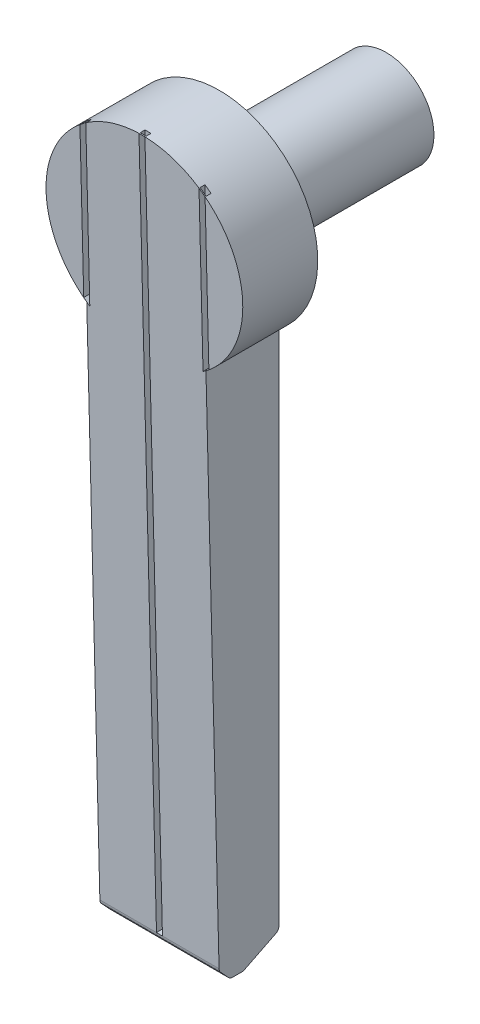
SolidWorks part; units mm, degrees
ref_plane "前视基准面" through (0, 0, 0) normal (0, 0, 1) x (1, 0, 0)
ref_plane "上视基准面" through (0, 0, 0) normal (0, 1, 0) x (1, 0, 0)
ref_plane "右视基准面" through (0, 0, 0) normal (1, 0, 0) x (0, 0, -1)
sketch "草图1" plane through (0, 0, 0) normal (0, 0, 1) x (1, 0, 0)
  line L0 (0, 0) -> (0, 81.7425) construction
  line L1 (-10, -60) -> (10, -60)
  line L2 (-10, -60) -> (-10, 30.3756)
  line L4 (10, -60) -> (10, 30.3756)
  line L5 (-10, -60) -> (9.4986, 56.9917) construction
  line L6 (-9.4986, 56.9917) -> (10, -60) construction
  arc A0 (10, 30.3756) -> (-10, 30.3756) centre (0, 43.5) ccw
  point P0 (0, 0)
  dimension "D3" = 33
  dimension "D2" = 120
  dimension "D1" = 20
  dimension "D4" = 43.5
extrude "拉伸1" add sketch "草图1" along normal blind 13
sketch "草图2" plane through (0, 0, 0) normal (0, 0, -1) x (-1, 0, 0)
  circle A0 centre (0, 43.5) radius 8
  dimension "D1" = 16
extrude "拉伸2" add sketch "草图2" along normal blind 28
sketch "草图5" plane through (-10, 0, 0) normal (-1, 0, 0) x (0, 0, 1)
  line L0 (13, 60) -> (10, -60)
  line L1 (13, -60) -> (0, -60) construction
  line L2 (13, 30.3756) -> (13, -60) construction
  line L3 (13, 60) -> (13, -60)
  line L4 (13, -60) -> (10, -60)
  dimension "D1" = 10
extrude "拉伸4" cut sketch "草图5" against normal mid plane 500
sketch "草图6" plane through (-10, 0, 0) normal (-1, 0, 0) x (0, 0, 1)
  line L0 (10.05, -58) -> (8.2, -60)
  line L1 (6, -60) -> (0, -57)
  line L2 (10, -60) -> (0, -60) construction
  line L3 (10, -60) -> (12.2594, 30.3756) construction
  line L4 (0, 30.3756) -> (0, -60) construction
  line L5 (0, -57) -> (0, -60)
  line L6 (10, -60) -> (8.2, -60)
  line L7 (10, -60) -> (10.05, -58)
  line L8 (6, -60) -> (0, -60)
  dimension "D1" = 2
  dimension "D2" = 1.8
  dimension "D3" = 6
  dimension "D4" = 3
extrude "拉伸5" cut sketch "草图6" against normal through all
fillet "圆角1" radius 1 4 edges at (0, -57, 0) (0, -58, 10.05) (0, -60, 8.2) (0, -60, 6)
sketch "草图7" plane through (0, -0.2873, 11.4928) normal (0, -0.025, 0.9997) x (1, 0, 0)
  line B0 (10, 30.6766) -> (10, 56.9254) construction
  line B1 (-10, 30.6766) -> (-10, 56.9254) construction
  line B2 (-10, 16.2152) -> (-10, 72.0479) construction
  line B3 (9.5, 30.3103) -> (9.5, 57.2917)
  line B4 (10.5, 31.0731) -> (10.5, 56.5289)
  line B5 (-10.5, 31.0731) -> (-10.5, 56.5289)
  line B6 (-9.5, 30.3103) -> (-9.5, 57.2917)
  arc B7 (9.5, 30.3103) -> (10.5, 31.0731) centre (0, 43.801) ccw
  arc B8 (-9.5, 57.2917) -> (-10.5, 56.5289) centre (0, 43.801) ccw
  arc B9 (10.5, 56.5289) -> (9.5, 57.2917) centre (0, 43.801) ccw
  arc B10 (0.5, 60.2934) -> (-0.5, 60.2934) centre (0, 43.801) ccw
  arc B11 (10.5, 56.5289) -> (9.5, 57.2917) centre (0, 43.801) ccw
  arc B12 (-9.5, 30.3103) -> (-10.5, 31.0731) centre (0, 43.801) cw
  arc B13 (-9.5, 57.2917) -> (-10.5, 56.5289) centre (0, 43.801) ccw
  line B14 (0.5, 60.2934) -> (0.5, -68.5792)
  line B15 (0.5, -68.5792) -> (-0.5, -68.5792)
  line B16 (-0.5, -68.5792) -> (-0.5, 60.2934)
sketch_block_instance "块6-1"
sketch_block "块6"
extrude "拉伸6" cut sketch "草图7" against normal blind 1 contours B14 B10 B16 M2 | B4 B9 B3 B7 | B12 B6 B8 B5
